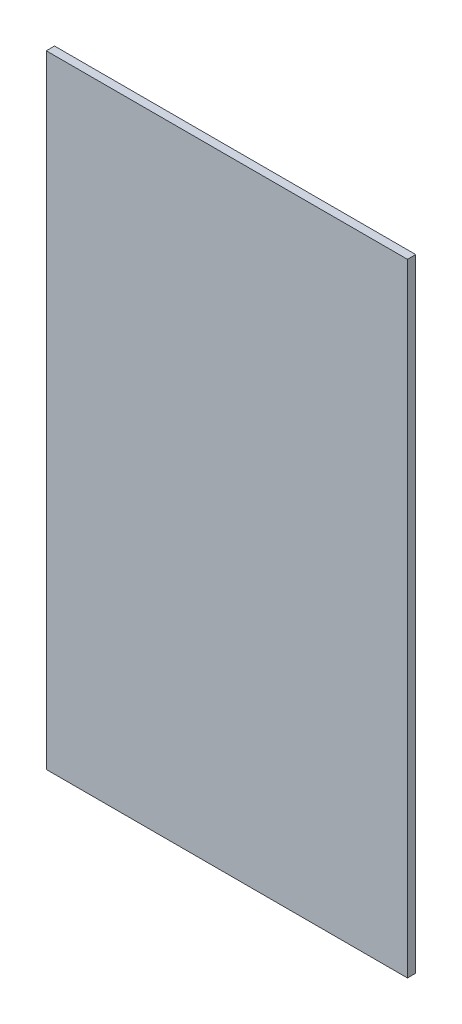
SolidWorks part; units mm, degrees
ref_plane "Front Plane" through (0, 0, 0) normal (0, 0, 1) x (1, 0, 0)
ref_plane "Top Plane" through (0, 0, 0) normal (0, 1, 0) x (1, 0, 0)
ref_plane "Right Plane" through (0, 0, 0) normal (1, 0, 0) x (0, 0, -1)
sketch "Sketch1" plane through (0, 0, 0) normal (0, 0, 1) x (1, 0, 0)
  line L5 (-752.8, 1183.8) -> (-752.8, -10)
  line L6 (-60, 1183.8) -> (-60, -10)
  line L7 (0, -10) -> (-762, -10)
  line L9 (-752.8, -10) -> (-60, -10)
  line L10 (-752.8, -10) -> (-752.8, 1183.8)
  line L11 (-752.8, 1183.8) -> (-60, 1183.8)
  line L12 (-60, -10) -> (-60, 1183.8)
  dimension "D1" = 1193.8
  dimension "D2" = 692.8
extrude "Boss-Extrude1" add sketch "Sketch1" along normal blind 15.875
